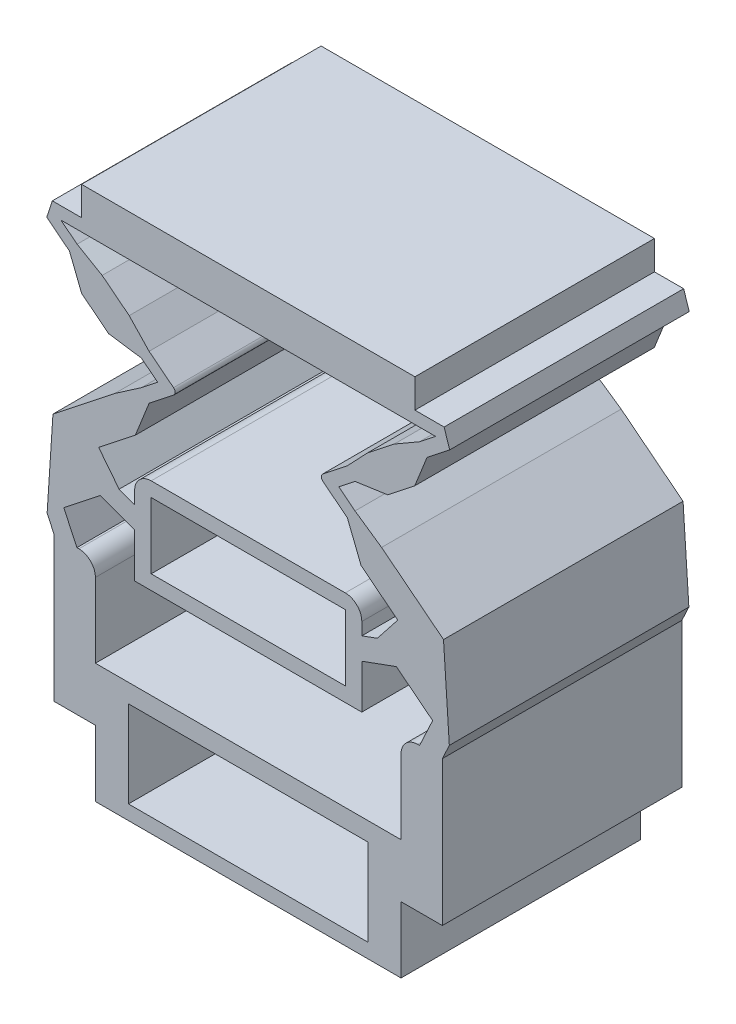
SolidWorks part; units mm, degrees
ref_plane "前视基准面" through (0, 0, 0) normal (0, 0, 1) x (1, 0, 0)
ref_plane "上视基准面" through (0, 0, 0) normal (0, 1, 0) x (1, 0, 0)
ref_plane "右视基准面" through (0, 0, 0) normal (1, 0, 0) x (0, 0, -1)
other "Configuration Table"
sketch "草图1" plane through (0, 0, 0) normal (0, 0, 1) x (1, 0, 0)
  line L0 (2.75, 5.2) -> (3.1259, 5.3368)
  line L1 (-3.7, -1.4) -> (3.7, -1.4)
  line L2 (-3.7, -1.4) -> (-3.7, 1.4)
  line L4 (3.7, -1.4) -> (3.7, 0.1)
  line L5 (-3.7, -1.4) -> (3.7, 1.4) construction
  line L6 (-3.7, 1.4) -> (3.7, -1.4) construction
  line L7 (-2.75, 5.2) -> (2.75, 5.2)
  line L8 (-2.75, 5.2) -> (-2.75, 3.6)
  line L9 (-2.75, 3.6) -> (2.75, 3.6)
  line L10 (2.75, 4.6679) -> (2.75, 3.6)
  line L11 (-2.75, 5.2) -> (2.75, 3.6) construction
  line L12 (-2.75, 3.6) -> (2.75, 5.2) construction
  line L14 (3.7, 0.1) -> (4.7, 0.1)
  line L17 (3.9926, 6.4362) -> (3.1259, 5.3368)
  line L19 (3.9926, 6.4362) -> (5.8774, 4.9503)
  line L33 (2.75, 5.2) -> (2.75, 4.6679) construction
  line L34 (3.1259, 5.3368) -> (3.5876, 4.9728) construction
  line L37 (4.7, 3.6) -> (4.7, 0.1)
  line L38 (-3.7, 1.4) -> (3.7, 1.4)
  line L39 (3.7, 1.4) -> (3.7, 0.1) construction
  line L40 (0, 9.062) -> (0, -4.0269) construction
  line L41 (2.75, 4.6679) -> (3.5876, 4.9728)
  line L48 (3.5876, 4.9728) -> (4.4657, 4.2805)
  line L51 (4.1483, 3.6) -> (4.4657, 4.2805)
  line L53 (4.869, 3.9625) -> (5.0106, 3.8509)
  line L55 (4.4657, 4.2805) -> (4.869, 3.9625) construction
  line L56 (4.1483, 3.6) -> (4.7, 3.6) construction
  line L57 (3.7, 1.4) -> (3.7, 3.6)
  line L58 (3.7, 3.6) -> (4.1483, 3.6)
  line L59 (4.7, 3.6) -> (4.869, 3.9625)
  line L60 (5.0106, 3.8509) -> (5.8774, 4.9503)
  point P0 (0, 0)
  point P6 (0, 4.4)
  dimension "D1" = 7.4
  dimension "D2" = 2.8
  dimension "D3" = 5.5
  dimension "D4" = 1.6
  dimension "D5" = 1
  dimension "D6" = 0.4
  dimension "D7" = 0.4
  dimension "D8" = 0.5
  dimension "D9" = 3.5
  dimension "D10" = 1.4
  dimension "D11" = 0.5
  dimension "D12" = 2.2
  dimension "D13" = 65
  dimension "D14" = 2.2
  dimension "D15" = 2.4
  dimension "D16" = 110
extrude "凸台-拉伸1" add sketch "草图1" along normal blind 5.8
mirror "镜向1" about plane through (0, 0, 0) normal (1, 0, 0) of "凸台-拉伸1"
sketch "草图10" plane through (0, 0, 5.8) normal (0, 0, 1) x (1, 0, 0)
  line L0 (-2.75, 3.6) -> (2.75, 3.6) construction
  line L1 (-2.9, -1.05) -> (2.9, -1.05)
  line L2 (-2.9, -1.05) -> (-2.9, 1.05)
  line L3 (-2.9, 1.05) -> (2.9, 1.05)
  line L4 (2.9, -1.05) -> (2.9, 1.05)
  line L5 (-2.9, -1.05) -> (2.9, 1.05) construction
  line L6 (-2.9, 1.05) -> (2.9, -1.05) construction
  line L7 (-2.35, 5.55) -> (2.35, 5.55)
  line L8 (-2.35, 5.55) -> (-2.35, 3.95)
  line L9 (-2.35, 3.95) -> (2.35, 3.95)
  line L10 (2.35, 5.55) -> (2.35, 3.95)
  point P0 (0, 0)
  point P10 (0, 5.55)
  dimension "D1" = 5.8
  dimension "D2" = 2.1
  dimension "D3" = 4.7
  dimension "D4" = 1.6
  dimension "D5" = 0.35
extrude "切除-拉伸3" cut sketch "草图10" against normal through all
sketch "草图11" plane through (0, 0, 5.8) normal (0, 0, 1) x (1, 0, 0)
  line L0 (-2.35, 5.2) -> (-2.75, 5.2)
  line L1 (-2.75, 5.2) -> (-2.75, 5.9)
  line L2 (-2.75, 5.9) -> (2.75, 5.9)
  line L3 (2.75, 5.9) -> (2.75, 5.2)
  line L4 (2.75, 3.6) -> (2.75, 4.6679) construction
  line L5 (2.75, 5.2) -> (2.35, 5.2)
  line L6 (2.35, 5.2) -> (2.35, 5.55)
  line L7 (2.35, 5.55) -> (-2.35, 5.55)
  line L8 (-2.35, 5.55) -> (-2.35, 5.2)
  line L9 (-2.35, 3.95) -> (2.35, 3.95) construction
  dimension "D1" = 0.35
  dimension "D2" = 1.6
extrude "凸台-拉伸2" add sketch "草图11" against normal up to surface (5.8 mm away)
fillet "圆角1" radius 0.4 2 edges at (-2.75, 5.9, 2.9) (2.75, 5.9, 2.9)
sketch "草图13" plane through (0, 0, 5.8) normal (0, 0, 1) x (1, 0, 0)
  line L4 (-4.869, 3.9625) -> (-4.7459, 5.8424)
  line L8 (-5.8774, 4.9503) -> (-3.9926, 6.4362) construction
  line L9 (-4.7459, 5.8424) -> (-5.8774, 4.9503)
  line L10 (-5.8774, 4.9503) -> (-5.0106, 3.8509)
  line L11 (-5.0106, 3.8509) -> (-4.869, 3.9625)
  line L12 (4.869, 3.9625) -> (5.0106, 3.8509)
  line L13 (5.0106, 3.8509) -> (5.8774, 4.9503)
  line L14 (5.8774, 4.9503) -> (4.7459, 5.8424)
  line L15 (5.8774, 4.9503) -> (3.9926, 6.4362) construction
  line L16 (4.7459, 5.8424) -> (4.869, 3.9625)
  dimension "D1" = 48
  dimension "D2" = 48
extrude "切除-拉伸4" cut sketch "草图13" against normal through all
sketch "草图14" plane through (0, 0, 5.8) normal (0, 0, 1) x (1, 0, 0)
  line L0 (2.9, -1.05) -> (2.9, 1.05) construction
  line L1 (-2.9, 1.05) -> (2.9, 1.05)
  line L2 (-2.9, 1.05) -> (-2.9, 0.95)
  line L3 (-2.9, 0.95) -> (2.9, 0.95)
  line L4 (2.9, 1.05) -> (2.9, 0.95)
  line L5 (3.7, -1.4) -> (3.7, 0.1) construction
  line L6 (-3.7, -1.4) -> (3.7, -1.4)
  line L7 (-3.7, -1.4) -> (-3.7, -1.5)
  line L8 (-3.7, -1.5) -> (3.7, -1.5)
  line L9 (3.7, -1.4) -> (3.7, -1.5)
  dimension "D1" = 0.1
  dimension "D2" = 0.1
extrude "凸台-拉伸4" add sketch "草图14" against normal up to surface (5.8 mm away)
sketch "草图15" plane through (0, 0, 5.8) normal (0, 0, 1) x (1, 0, 0)
  line L0 (2.9, -1.05) -> (2.9, 0.95) construction
  line L1 (-2.9, -1.05) -> (2.9, -1.05)
  line L2 (-2.9, -1.05) -> (-2.9, -1.15)
  line L3 (-2.9, -1.15) -> (2.9, -1.15)
  line L4 (2.9, -1.05) -> (2.9, -1.15)
  dimension "D1" = 0.1
extrude "切除-拉伸5" cut sketch "草图15" against normal through all
sketch "草图12" plane through (0, 0, 5.8) normal (0, 0, 1) x (1, 0, 0)
  line L0 (-3.9926, 6.4362) -> (-1.9509, 8.0459) construction
  line L1 (-4.7459, 5.8424) -> (-3.9926, 6.4362) construction
  line L2 (-1.9509, 8.0459) -> (-4.7779, 10.2747) construction
  line L3 (-2.5858, 7.7364) -> (-2.1931, 8.0459)
  line L5 (-2.6167, 7.7756) -> (-2.5858, 7.7364) construction
  line L6 (-2.8334, 8.0414) -> (-2.5858, 8.3555) construction
  line L7 (-3.9926, 6.4362) -> (-3.1259, 5.3368) construction
  line L8 (-2.4001, 7.5008) -> (-2.1215, 7.1474) construction
  line L18 (-2.1215, 7.1474) -> (-2.6167, 7.7756) construction
  line L19 (-2.1215, 7.1474) -> (-3.6212, 5.965) construction
  line L20 (-3.9926, 6.4362) -> (-1.9509, 8.0459) construction
  line L53 (-2.1931, 8.0459) -> (-2.5858, 8.3555)
  line L54 (-2.4001, 7.5008) -> (-1.7086, 8.0459)
  line L55 (-1.7086, 8.0459) -> (-2.4001, 8.5911)
  line L56 (-4.7459, 5.8424) -> (-4.7283, 6.1109)
  line L57 (-4.7283, 6.1109) -> (-2.6167, 7.7756) construction
  line L58 (-4.869, 3.9625) -> (-4.7459, 5.8424) construction
  line L59 (-4.3287, 9.7296) -> (-5.0202, 10.2747) construction
  line L60 (-2.4001, 7.5008) -> (-2.5858, 7.7364) construction
  line L61 (-2.5858, 8.3555) -> (-2.4001, 8.5911) construction
  line L62 (-2.8334, 8.0414) -> (-2.3381, 8.6696) construction
  line L63 (-2.3381, 8.6696) -> (-4.0811, 10.0437) construction
  line L64 (-2.8334, 8.0414) -> (-4.5764, 9.4155) construction
  line L65 (-4.5764, 9.4155) -> (-4.0811, 10.0437) construction
  line L66 (-5.0202, 10.2747) -> (-5.0202, 10.5747) construction
  line L67 (-4.7779, 10.2747) -> (4.8328, 10.2747) construction
  line L68 (-4.143, 9.9652) -> (-4.5357, 10.2747)
  line L69 (-4.5357, 10.2747) -> (-4.0357, 10.2747)
  line L70 (-4.0357, 10.2747) -> (-4.0357, 11.2747) construction
  line L74 (-5.0202, 10.5747) -> (-4.0357, 10.5747) construction
  line L75 (-2.3381, 8.6696) -> (-2.4001, 8.5911) construction
  line L76 (-4.7459, 5.8424) -> (-3.9926, 6.4362)
  line L77 (-3.9926, 6.4362) -> (-3.6212, 5.965)
  line L78 (-4.5764, 9.4155) -> (-4.3287, 9.7296) construction
  line L79 (-4.143, 9.9652) -> (-4.0811, 10.0437) construction
  line L80 (-4.0357, 10.5747) -> (-4.0357, 11.2747)
  line L81 (0, 7.7035) -> (0, 13.757) construction
  line L105 (3.9926, 6.4362) -> (2.1079, 7.9221) construction
  line L106 (2.1079, 7.9221) -> (4.8328, 10.2747) construction
  line L107 (-4.7283, 6.1109) -> (-3.2288, 7.2931)
  line L108 (-3.2288, 7.2931) -> (-2.5858, 7.7364)
  line L109 (-3.6212, 5.965) -> (-2.7335, 6.6648)
  line L110 (-2.7335, 6.6648) -> (-2.4001, 7.5008)
  line L111 (-2.5858, 8.3555) -> (-3.3775, 8.4703)
  line L112 (-3.3775, 8.4703) -> (-4.0323, 8.9865)
  line L113 (-4.0323, 8.9865) -> (-4.3287, 9.7296)
  line L114 (-2.4001, 8.5911) -> (-2.8822, 9.0985)
  line L115 (-2.8822, 9.0985) -> (-3.537, 9.6148)
  line L116 (-3.537, 9.6148) -> (-4.143, 9.9652)
  line L117 (-4.3287, 9.7296) -> (-4.8785, 10.163)
  line L118 (-4.8785, 10.163) -> (-4.7427, 10.5747)
  line L119 (-4.7427, 10.5747) -> (-4.0357, 10.5747)
  line L120 (-2.7335, 6.6648) -> (-3.2288, 7.2931) construction
  line L121 (-3.3775, 8.4703) -> (-2.8822, 9.0985) construction
  line L122 (-4.0323, 8.9865) -> (-3.537, 9.6148) construction
  line L148 (4.7459, 5.8424) -> (3.9926, 6.4362) construction
  line L149 (4.0357, 10.5747) -> (4.0357, 11.2747)
  line L150 (4.143, 9.9652) -> (4.5357, 10.2747)
  line L151 (4.5357, 10.2747) -> (4.0357, 10.2747)
  line L152 (4.7427, 10.5747) -> (4.0357, 10.5747)
  line L153 (4.8785, 10.163) -> (4.7427, 10.5747)
  line L154 (4.3287, 9.7296) -> (4.8785, 10.163)
  line L155 (4.0323, 8.9865) -> (4.3287, 9.7296)
  line L156 (3.537, 9.6148) -> (4.143, 9.9652)
  line L157 (2.8822, 9.0985) -> (3.537, 9.6148)
  line L158 (3.3775, 8.4703) -> (4.0323, 8.9865)
  line L159 (2.5858, 8.3555) -> (3.3775, 8.4703)
  line L160 (2.4001, 8.5911) -> (2.8822, 9.0985)
  line L161 (1.7086, 8.0459) -> (2.4001, 8.5911)
  line L162 (2.1931, 8.0459) -> (2.5858, 8.3555)
  line L163 (2.5858, 7.7364) -> (2.1931, 8.0459)
  line L164 (2.4001, 7.5008) -> (1.7086, 8.0459)
  line L165 (2.7335, 6.6648) -> (2.4001, 7.5008)
  line L166 (3.2288, 7.2931) -> (2.5858, 7.7364)
  line L167 (3.6212, 5.965) -> (2.7335, 6.6648)
  line L168 (4.7283, 6.1109) -> (3.2288, 7.2931)
  line L169 (4.7459, 5.8424) -> (4.7283, 6.1109)
  line L170 (3.9926, 6.4362) -> (3.6212, 5.965)
  line L171 (4.7459, 5.8424) -> (3.9926, 6.4362)
  line L172 (-4.0357, 11.2747) -> (4.0357, 11.2747)
  line L173 (-4.0357, 10.2747) -> (4.0357, 10.2747)
  dimension "D1" = 2.6
  dimension "D2" = 3.6
  dimension "D3" = 0.15
  dimension "D4" = 2.4
  dimension "D5" = 0.5
  dimension "D6" = 0.15
  dimension "D7" = 0.5
  dimension "D8" = 0.5
  dimension "D9" = 0.8
  dimension "D10" = 0.2
  dimension "D11" = 0.8
  dimension "D12" = 0.15
  dimension "D13" = 0.15
  dimension "D14" = 3.6
  dimension "D15" = 60
  dimension "D16" = 0.5
  dimension "D17" = 60
  dimension "D18" = 0.15
  dimension "D19" = 60
  dimension "D20" = 0.7
  dimension "D21" = 0.3
  dimension "D22" = 110
  dimension "D23" = 0.7
  dimension "D24" = 0.55
extrude "凸台-拉伸3" add sketch "草图12" against normal up to surface (5.8 mm away)
fillet "圆角2" radius 0.4 2 edges at (3.7, 3.6, 2.9) (-3.7, 3.6, 2.9)
fillet "圆角3" radius 0.1 2 edges at (1.7086, 8.0459, 2.9) (-1.7086, 8.0459, 2.9)
